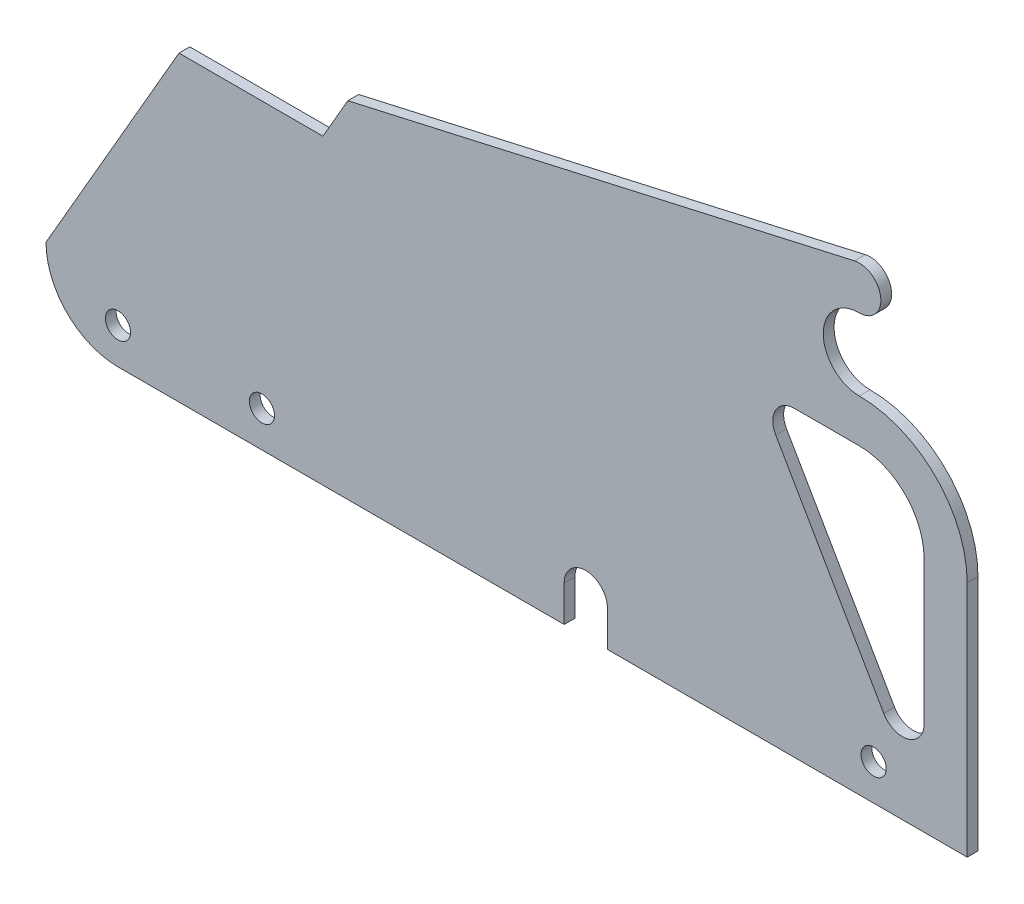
SolidWorks part; units mm, degrees
ref_plane "Front Plane" through (0, 0, 0) normal (0, 0, 1) x (1, 0, 0)
ref_plane "Top Plane" through (0, 0, 0) normal (0, 1, 0) x (1, 0, 0)
ref_plane "Right Plane" through (0, 0, 0) normal (1, 0, 0) x (0, 0, -1)
sketch "Sketch1" plane through (0, 0, 0) normal (0, 0, 1) x (1, 0, 0)
  line L0 (0, 33) -> (0, 0)
  line L1 (0, 0) -> (-50, 0)
  line L2 (0, 33) -> (-15, 33) construction
  line L3 (-15, 33) -> (-15, 61) construction
  line L4 (-6, 33) -> (-6, 13)
  line L5 (-24.0111, 42) -> (-15, 42)
  line L6 (-26.6092, 37.5) -> (-11.5981, 11.5)
  line L7 (-15.662, 63.9261) -> (-86.0607, 48)
  line L8 (-86.0607, 48) -> (-89.5248, 42)
  line L9 (-89.5248, 42) -> (-109.5248, 42)
  line L10 (-109.5248, 42) -> (-128, 10)
  line L11 (-56, 5) -> (-56, 0)
  line L12 (-50, 5) -> (-50, 0)
  line L13 (-56, 0) -> (-118, 0)
  line L14 (0, 5) -> (-118, 5) construction
  line L15 (-118, 10) -> (-118, 0) construction
  line L16 (-118, 10) -> (-128, 10) construction
  arc A0 (0, 33) -> (-15, 48) centre (-15, 33) ccw
  arc A1 (-15, 58) -> (-15, 48) centre (-15, 53) ccw
  arc A2 (-15, 58) -> (-15.662, 63.9261) centre (-15, 61) ccw
  arc A3 (-6, 33) -> (-15, 42) centre (-15, 33) ccw
  arc A4 (-11.5981, 11.5) -> (-6, 13) centre (-9, 13) ccw
  arc A5 (-24.0111, 42) -> (-26.6092, 37.5) centre (-24.0111, 39) ccw
  arc A6 (-128, 10) -> (-118, 0) centre (-118, 10) ccw
  arc A7 (-50, 5) -> (-56, 5) centre (-53, 5) ccw
  circle A8 centre (-13, 5) radius 1.75
  circle A9 centre (-98, 5) radius 1.75
  circle A10 centre (-118, 5) radius 1.75
  dimension "D2" = 3
  dimension "D3" = 5
  dimension "D4" = 15
  dimension "D5" = 9
  dimension "D6" = 3
  dimension "D7" = 3
  dimension "D11" = 13
  dimension "D12" = 40
  dimension "D13" = 20
  dimension "D14" = 45
  dimension "D18" = 3
  dimension "D20" = 3.5
  dimension "D21" = 10
  dimension "D1" = 60
  dimension "D8" = 13
  dimension "D9" = 20
  dimension "D10" = 60
  dimension "D15" = 60
  dimension "D16" = 6
  dimension "D17" = 20
  dimension "D19" = 5
  dimension "D22" = 42
extrude "Extrude1" add sketch "Sketch1" along normal blind 1.5
